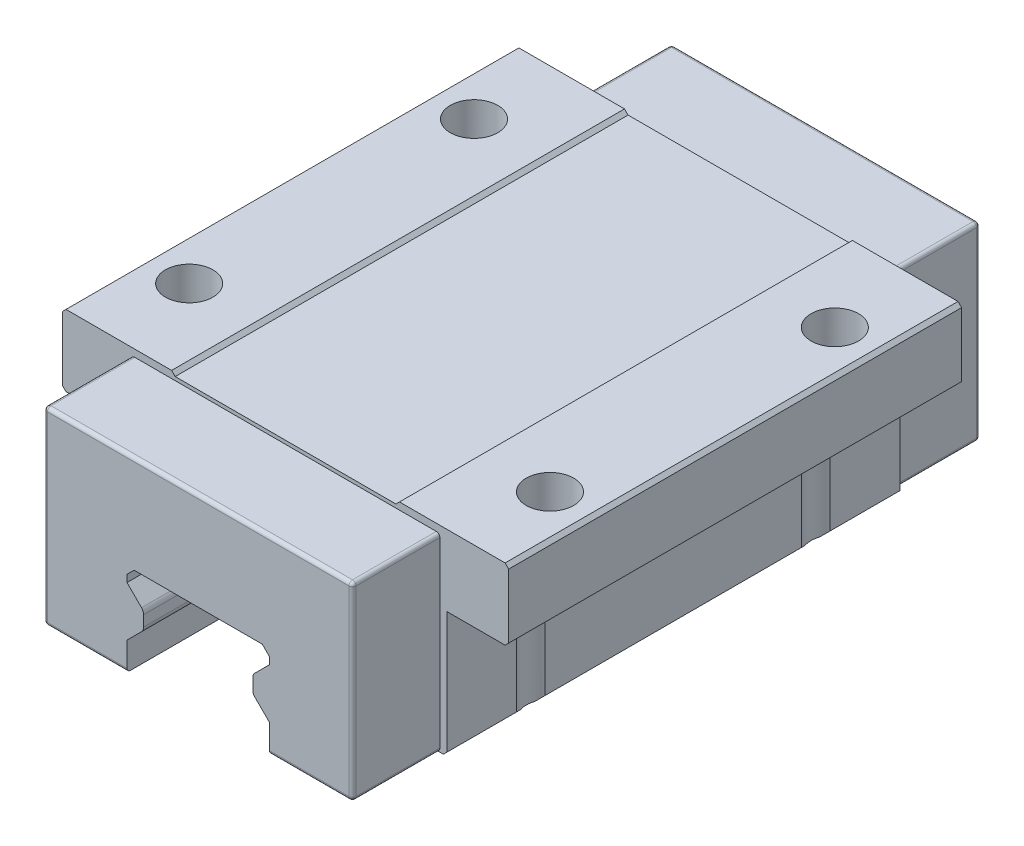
SolidWorks part; units mm, degrees
ref_plane "Front Plane" through (0, 0, 0) normal (0, 0, 1) x (1, 0, 0)
ref_plane "Top Plane" through (0, 0, 0) normal (0, 1, 0) x (1, 0, 0)
ref_plane "Right Plane" through (0, 0, 0) normal (1, 0, 0) x (0, 0, -1)
sketch "Sketch1" plane through (0, 0, 0) normal (0, 0, 1) x (1, 0, 0)
  line L1 (-17, 3.3) -> (17, 3.3)
  line L2 (-17, 3.3) -> (-17, 24)
  line L3 (-17, 24) -> (17, 24)
  line L4 (17, 3.3) -> (17, 24)
  line L5 (-17, 3.3) -> (17, 24) construction
  line L6 (-17, 24) -> (17, 3.3) construction
  point P0 (0, 13.65)
  dimension "D1" = 24
  dimension "D2" = 3.3
  dimension "D3" = 34
extrude "Boss-Extrude1" add sketch "Sketch1" along normal mid plane 47.7
sketch "Sketch2" plane through (0, 0, 0) normal (0, 0, 1) x (1, 0, 0)
  line L0 (-17, 3.3) -> (17, 3.3) construction
  line L1 (-16.25, 3.3) -> (16.25, 3.3)
  line L2 (-16.25, 3.3) -> (-16.25, 23.25)
  line L3 (-16.25, 23.25) -> (16.25, 23.25)
  line L4 (16.25, 3.3) -> (16.25, 23.25)
  line L5 (-16.25, 23.25) -> (-17, 23.25) construction
  line L6 (-17, 24) -> (-17, 3.3) construction
  line L7 (16.25, 23.25) -> (16.25, 24) construction
  line L8 (17, 24) -> (-17, 24) construction
  line L9 (16.25, 23.25) -> (17, 23.25) construction
  line L10 (17, 3.3) -> (17, 24) construction
  point P9 (0, 23.25)
  dimension "D1" = 0.75
extrude "Boss-Extrude2" add sketch "Sketch2" along normal mid plane 66.1
sketch "Sketch3" plane through (0, 0, 33.05) normal (0, 0, 1) x (1, 0, 0)
  line L1 (-7.5, 13) -> (7.5, 13)
  line L2 (-7.5, 13) -> (-7.5, 0)
  line L3 (-7.5, 0) -> (7.5, 0)
  line L4 (7.5, 13) -> (7.5, 0)
  line L5 (-7.5, 13) -> (7.5, 0) construction
  line L6 (-7.5, 0) -> (7.5, 13) construction
  point P0 (0, 6.5)
  dimension "D1" = 15
  dimension "D2" = 13
extrude "Cut-Extrude1" cut sketch "Sketch3" against normal through all
sketch "Sketch4" plane through (0, 0, 33.05) normal (0, 0, 1) x (1, 0, 0)
  line L0 (-7.5, 11.5) -> (-7.5, 6.25)
  line L1 (-7.5, 13) -> (-7.5, 3.3) construction
  line L2 (-7.5, 6.25) -> (-5.75, 8)
  line L3 (-5.75, 8) -> (-5.75, 9.75)
  line L4 (-5.75, 9.75) -> (-7.5, 11.5)
  line L5 (7.5, 13) -> (-7.5, 13) construction
  line L6 (-5.75, 9.75) -> (-7.5, 9.75) construction
  line L7 (-5.75, 8) -> (-7.5, 8) construction
  line L8 (-6.625, 9.75) -> (-6.625, 8) construction
  line L9 (0, 0) -> (0, 13) construction
  line L10 (6.625, 9.75) -> (6.625, 8) construction
  line L11 (5.75, 8) -> (7.5, 8) construction
  line L12 (5.75, 9.75) -> (7.5, 9.75) construction
  line L13 (5.75, 9.75) -> (7.5, 11.5)
  line L14 (5.75, 8) -> (5.75, 9.75)
  line L15 (7.5, 6.25) -> (5.75, 8)
  line L16 (7.5, 11.5) -> (7.5, 6.25)
extrude "Boss-Extrude3" add sketch "Sketch4" against normal up to surface (66.1 mm away)
chamfer "Chamfer1" distance 0.75 angle 45 2 edges at (7.5, 13, 0) (-7.5, 13, 0)
fillet "Fillet1" radius 0.75 4 edges at (5.75, 8, 0) (5.75, 9.75, 0) (-5.75, 8, 0) (-5.75, 9.75, 0)
sketch "Sketch5" plane through (0, 0, 23.85) normal (0, 0, 1) x (1, 0, 0)
  line L0 (17, 24) -> (-17, 24) construction
  line L1 (-12, 24) -> (12, 24)
  line L2 (-12, 24) -> (-12, 23.625)
  line L3 (-12, 23.625) -> (12, 23.625)
  line L4 (12, 24) -> (12, 23.625)
  point P6 (0, 23.625)
  dimension "D1" = 24
  dimension "D2" = 0.375
extrude "Cut-Extrude2" cut sketch "Sketch5" against normal through all
chamfer "Chamfer2" distance 0.375 angle 45 6 edges at (17, 24, 0) (17, 3.3, 0) (-17, 3.3, 0) (-17, 24, 0) (12, 23.625, 0) (-12, 23.625, 0)
fillet "Fillet2" radius 0.375 18 edges at (-16.25, 3.3, -28.45) (11.875, 3.3, 33.05) (11.875, 3.3, -33.05) (-16.25, 3.3, 28.45) (-11.875, 3.3, -33.05) (-11.875, 3.3, 33.05) (16.25, 3.3, 28.45) (-16.25, 13.275, 33.05) (-16.25, 13.275, -33.05) (-16.25, 23.25, 28.45) (16.25, 23.25, 28.45) (16.25, 13.275, 33.05) (16.25, 13.275, -33.05) (0, 23.25, 33.05) (0, 23.25, -33.05) (16.25, 3.3, -28.45) (16.25, 23.25, -28.45) (-16.25, 23.25, -28.45)
sketch "Sketch7" plane through (0, 0, 0) normal (0, 0, 1) x (1, 0, 0)
  line L0 (-16.625, 24) -> (-23.5, 24)
  line L1 (-23.5, 24) -> (-23.5, 16.5)
  line L2 (-16.625, 24) -> (-16.625, 10.375)
  line L3 (-17, 23.625) -> (-17, 3.675) construction
  line L4 (-17, 10.375) -> (-16.625, 10.375)
  line L5 (-23.5, 16.5) -> (-23.125, 16.5)
  line L6 (0, 0) -> (0, 23.625) construction
  line L7 (-11.625, 23.625) -> (11.625, 23.625) construction
  line L8 (23.5, 16.5) -> (23.125, 16.5)
  line L9 (17, 10.375) -> (16.625, 10.375)
  line L10 (16.625, 24) -> (16.625, 10.375)
  line L11 (23.5, 24) -> (23.5, 16.5)
  line L12 (16.625, 24) -> (23.5, 24)
  arc A1 (-23.125, 16.5) -> (-17, 10.375) centre (-23.125, 10.375) cw
  arc A2 (23.125, 16.5) -> (17, 10.375) centre (23.125, 10.375) ccw
  point P22 (-23.3125, 16.5)
  dimension "D1" = 47
  dimension "D2" = 7.5
  dimension "D3" = 0.375
extrude "Boss-Extrude4" add sketch "Sketch7" along normal mid plane 19.8
sketch "Sketch8" plane through (0, 0, 0) normal (0, 0, 1) x (1, 0, 0)
  line L0 (-23.5, 16.5) -> (-23.5, 24)
  line L9 (23.5, 16.5) -> (23.5, 24)
  line L10 (23.5, 16.5) -> (16.625, 16.5)
  line L11 (23.5, 24) -> (16.625, 24)
  line L13 (16.625, 24) -> (16.625, 16.5)
  line L14 (-23.5, 16.5) -> (-16.25, 16.5)
  line L15 (-23.5, 24) -> (-16.25, 24)
  line L16 (-16.25, 16.5) -> (-16.25, 24)
  line L17 (-16.25, 22.875) -> (-16.25, 3.675) construction
extrude "Boss-Extrude5" add sketch "Sketch8" along normal mid plane 47.7
chamfer "Chamfer3" distance 0.375 angle 45 4 edges at (-23.5, 16.5, 0) (-23.5, 24, 0) (23.5, 16.5, 0) (23.5, 24, 0)
fillet "Fillet3" radius 4 4 edges at (-17, 13.4375, 9.9) (-17, 13.4375, -9.9) (17, 13.4375, -9.9) (17, 13.4375, 9.9)
sketch "Sketch6" plane through (0, 24, 0) normal (0, 1, 0) x (1, 0, 0)
  line L1 (0, 0) -> (19, -15) construction
  line L3 (0, 0) -> (-19, -15) construction
  circle A1 centre (-19, -15) radius 2.5
  circle A2 centre (19, -15) radius 2.5
  dimension "D1" = 5
  dimension "D2" = 38
  dimension "D3" = 15
extrude "Cut-Extrude3" cut sketch "Sketch6" against normal blind 21
mirror "Mirror1" about plane through (0, 0, 0) normal (0, 0, 1) of "Cut-Extrude3"
equation "\"D2@Sketch4\"=\"D1@Sketch4\"*3.5"
